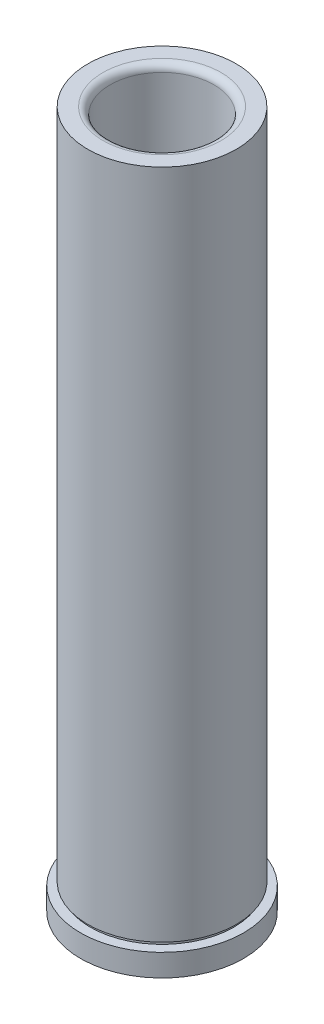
SolidWorks part; units mm, degrees
ref_plane "Front Plane" through (0, 0, 0) normal (0, 0, 1) x (1, 0, 0)
ref_plane "Top Plane" through (0, 0, 0) normal (0, 1, 0) x (1, 0, 0)
ref_plane "Right Plane" through (0, 0, 0) normal (1, 0, 0) x (0, 0, -1)
sketch "Sketch1" plane through (0, 0, 0) normal (0, 0, 1) x (1, 0, 0)
  line L0 (-736.3938, 0) -> (49263.6062, 0) construction
  line L1 (0, -1000) -> (0, 49000) construction
  line L2 (-11.1189, 149.225) -> (-11.1188, 104.775)
  line L4 (-17.4625, 0) -> (-17.4625, 4.7625)
  line L5 (-17.4625, 4.7625) -> (-15.3733, 4.7625)
  line L6 (-15.8814, 149.225) -> (-15.8813, 5.5245)
  line L7 (-15.8814, 149.225) -> (-11.1189, 149.225)
  line L8 (-12.3888, 0.7938) -> (-12.3888, 103.505)
  line L9 (-12.3888, 0.7938) -> (-13.1826, 0)
  line L10 (-15.8813, 5.5245) -> (-15.3733, 5.5245)
  line L11 (-15.3733, 5.5245) -> (-15.3733, 4.7625)
  line L12 (-13.1826, 0) -> (-17.4625, 0)
  arc A0 (-11.1188, 104.775) -> (-12.3888, 103.505) centre (-11.1189, 103.505) ccw
  dimension "D1" = 0.508
  dimension "OD" = 31.7627
  dimension "ID" = 22.2377
  dimension "FLANGETHICKNESS" = 4.7625
  dimension "FLANGEDIA" = 34.925
  dimension "D2" = 1.27
  dimension "D3" = 0.762
  dimension "D4" = 0.7937
  dimension "D5" = 45
  dimension "D6" = 149.225
  dimension "D7" = 44.45
revolve "Revolve1" add sketch "Sketch1" angle 360 about L1
fillet "Fillet1" radius 1.524 1 edges at (11.1188, 149.225, 0)
